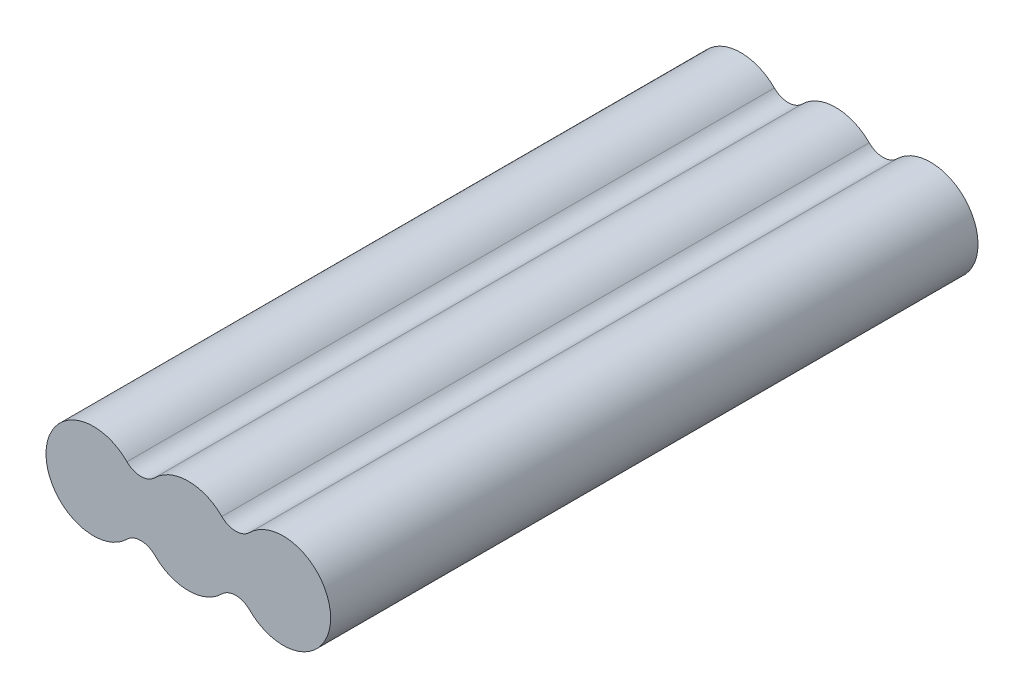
SolidWorks part; units mm, degrees
ref_plane "Front Plane" through (0, 0, 0) normal (0, 0, 1) x (1, 0, 0)
ref_plane "Top Plane" through (0, 0, 0) normal (0, 1, 0) x (1, 0, 0)
ref_plane "Right Plane" through (0, 0, 0) normal (1, 0, 0) x (0, 0, -1)
sketch "Sketch1" plane through (0, 0, 0) normal (0, 0, 1) x (1, 0, 0)
  line L0 (-19.05, 0) -> (0, 0) construction
  line L1 (0, 0) -> (19.05, 0) construction
  line L2 (-19.05, 0) -> (-12.3148, 6.7352) construction
  line L3 (-12.3148, 6.7352) -> (-6.7352, 6.7352) construction
  line L4 (-6.7352, 6.7352) -> (0, 0) construction
  line L5 (0, 0) -> (6.7352, 6.7352) construction
  line L6 (6.7352, 6.7352) -> (12.3148, 6.7352) construction
  line L7 (12.3148, 6.7352) -> (19.05, 0) construction
  arc A0 (-6.7352, -6.7352) -> (6.7352, -6.7352) centre (0, 0) ccw
  arc A1 (12.3148, -6.7352) -> (12.3148, 6.7352) centre (19.05, 0) ccw
  arc A2 (-12.3148, 6.7352) -> (-12.3148, -6.7352) centre (-19.05, 0) ccw
  arc A3 (-12.3148, 6.7352) -> (-6.7352, 6.7352) centre (-9.525, 9.525) ccw
  arc A4 (6.7352, 6.7352) -> (12.3148, 6.7352) centre (9.525, 9.525) ccw
  arc A5 (6.7352, -6.7352) -> (12.3148, -6.7352) centre (9.525, -9.525) cw
  arc A6 (-12.3148, -6.7352) -> (-6.7352, -6.7352) centre (-9.525, -9.525) cw
  arc A7 (6.7352, 6.7352) -> (-6.7352, 6.7352) centre (0, 0) ccw
  dimension "D1" = 19.05
  dimension "D2" = 45
  dimension "D3" = 19.05
  dimension "D4" = 19.05
extrude "Boss-Extrude1" add sketch "Sketch1" along normal blind 130
